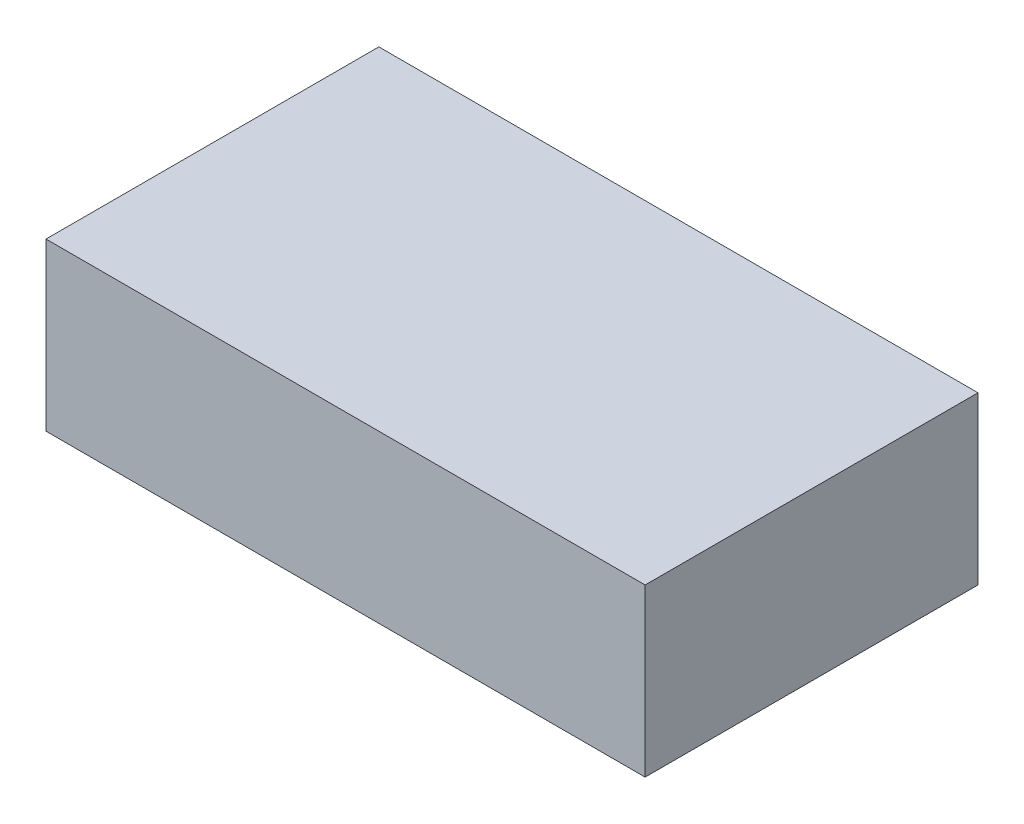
SolidWorks part; units mm, degrees
ref_plane "前视基准面" through (0, 0, 0) normal (0, 0, 1) x (1, 0, 0)
ref_plane "上视基准面" through (0, 0, 0) normal (0, 1, 0) x (1, 0, 0)
ref_plane "右视基准面" through (0, 0, 0) normal (1, 0, 0) x (0, 0, -1)
other "Configuration Table"
sketch "BaseSketch" plane through (0, 0, 0) normal (0, 1, 0) x (1, 0, 0)
  line L1 (0, 0) -> (90, 0)
  line L2 (0, 0) -> (0, 50)
  line L3 (0, 50) -> (90, 50)
  line L4 (90, 0) -> (90, 50)
  dimension "D1" = 90
  dimension "D2" = 50
extrude "BaseBoss" add sketch "BaseSketch" against normal blind 25
